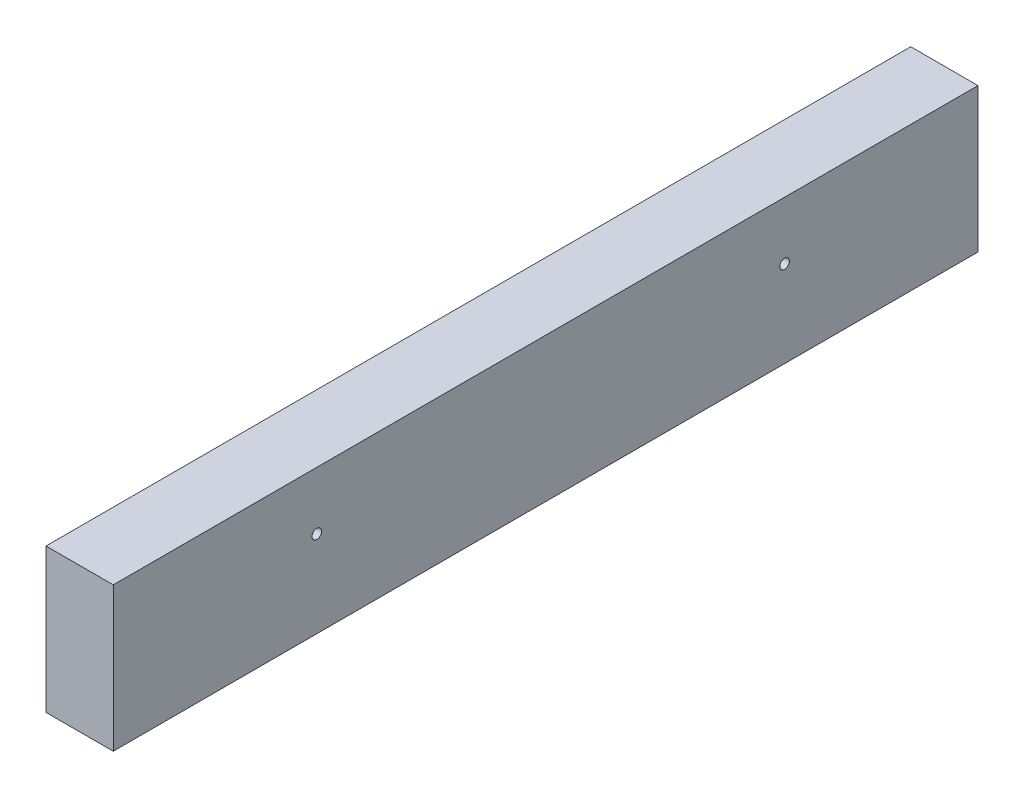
SolidWorks part; units mm, degrees
other "Cut-Extrude12[2]"
ref_plane "Front Plane" through (0, 0, 0) normal (0, 0, 1) x (1, 0, 0)
ref_plane "Top Plane" through (0, 0, 0) normal (0, 1, 0) x (1, 0, 0)
ref_plane "Right Plane" through (0, 0, 0) normal (1, 0, 0) x (0, 0, -1)
imported_body "Imported1"
sketch "Sketch1" plane through (0, 0, 0) normal (1, 0, 0) x (0, 0, -1)
  line L0 (412.0354, 570.52) -> (412.0354, 567.98)
  arc A0 (412.0354, 570.52) -> (412.0354, 567.98) centre (412.0354, 569.25) ccw construction
  arc A1 (412.0354, 570.52) -> (412.0354, 567.98) centre (412.0354, 569.25) ccw
extrude "Boss-Extrude1" add sketch "Sketch1" against normal up to next
